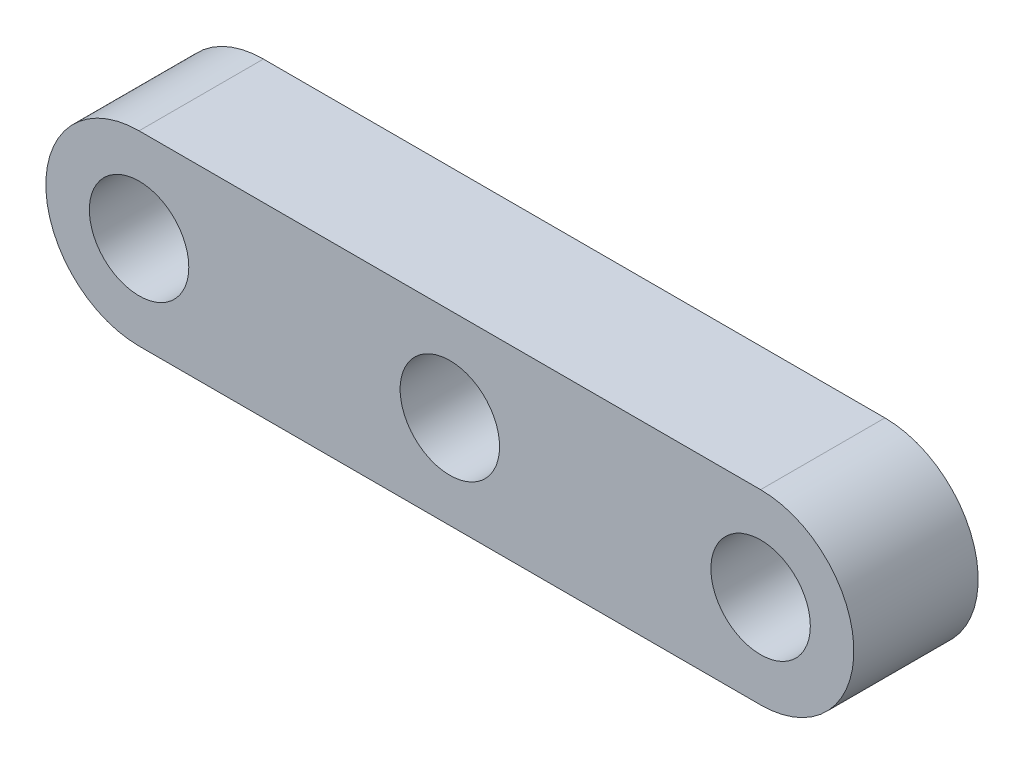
SolidWorks part; units mm, degrees
ref_plane "前视基准面" through (0, 0, 0) normal (0, 0, 1) x (1, 0, 0)
ref_plane "上视基准面" through (0, 0, 0) normal (0, 1, 0) x (1, 0, 0)
ref_plane "右视基准面" through (0, 0, 0) normal (1, 0, 0) x (0, 0, -1)
other "Configuration Table"
sketch "草图1" plane through (0, 0, 0) normal (0, 0, 1) x (1, 0, 0)
  line L0 (0, 0) -> (20, 0) construction
  line L1 (0, 3) -> (20, 3)
  line L2 (0, -3) -> (20, -3)
  line L3 (0, 0) -> (10, 0) construction
  arc A0 (0, 3) -> (0, -3) centre (0, 0) ccw
  arc A1 (20, -3) -> (20, 3) centre (20, 0) ccw
  circle A2 centre (0, 0) radius 1.6
  circle A3 centre (10, 0) radius 1.6
  circle A4 centre (20, 0) radius 1.6
  point P3 (10, 0)
  point P10 (0, 0)
  dimension "D3" = 3.2
  dimension "D4" = 3
  dimension "D1" = 10
  dimension "D2" = 3
extrude "凸台-拉伸1" add sketch "草图1" along normal mid plane 4
